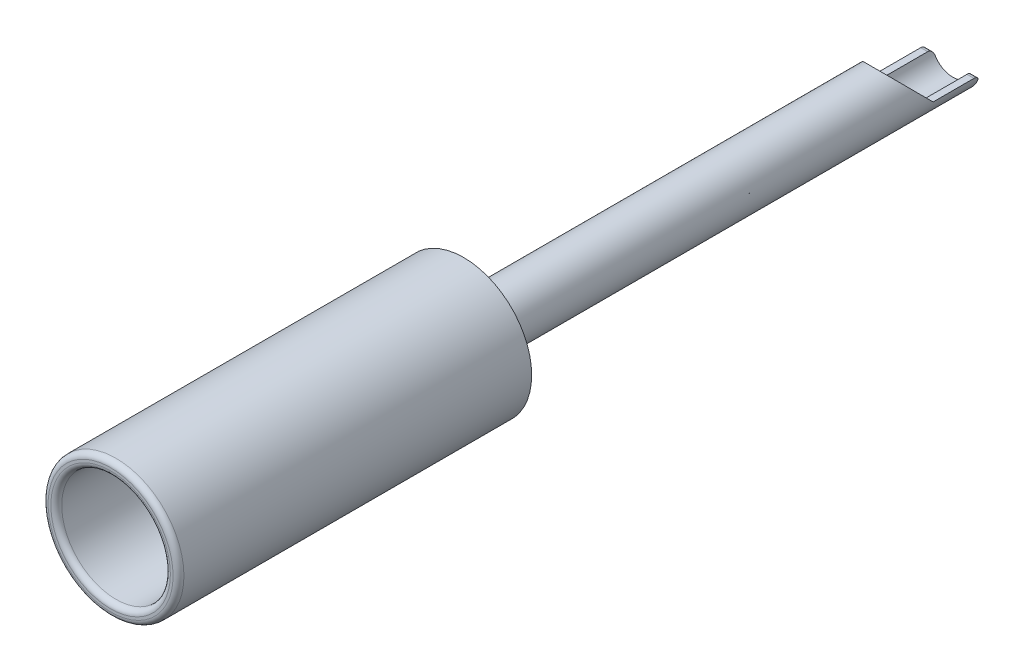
SolidWorks part; units mm, degrees
ref_plane "Plan de face" through (0, 0, 0) normal (0, 0, 1) x (1, 0, 0)
ref_plane "Plan de dessus" through (0, 0, 0) normal (0, 1, 0) x (1, 0, 0)
ref_plane "Plan de droite" through (0, 0, 0) normal (1, 0, 0) x (0, 0, -1)
sketch "Esquisse1" plane through (0, 0, 0) normal (0, 0, 1) x (1, 0, 0)
  circle A0 centre (0, 0) radius 2.5
  dimension "D1" = 5
extrude "Boss.-Extru.1" add sketch "Esquisse1" against normal blind 31
sketch "Esquisse2" plane through (0, 0, 0) normal (0, 0, 1) x (1, 0, 0)
  circle A0 centre (0, 0) radius 2
  dimension "D1" = 4
extrude "Enlèv. mat.-Extru.1" cut sketch "Esquisse2" against normal blind 12
sketch "Esquisse3" plane through (0, 0, -31) normal (0, 0, -1) x (-1, 0, 0)
  circle A0 centre (0, 0) radius 1
  dimension "D1" = 2
extrude "Enlèv. mat.-Extru.2" cut sketch "Esquisse3" against normal blind 18 flip side to cut
sketch "Esquisse4" plane through (0, 0, -31) normal (0, 0, -1) x (-1, 0, 0)
  circle A0 centre (0, 0) radius 0.5
  dimension "D1" = 1
extrude "Enlèv. mat.-Extru.5" cut sketch "Esquisse4" against normal through all
sketch "Esquisse5" plane through (0, 0, -31) normal (0, 0, -1) x (-1, 0, 0)
  circle A0 centre (0, 0) radius 0.75
  dimension "D1" = 1.5
extrude "Enlèv. mat.-Extru.6" cut sketch "Esquisse5" against normal blind 3
fillet "Congé1" radius 0.2 2 edges at (2.5, 0, 0) (2, 0, 0)
sketch "Esquisse6" plane through (0, 0, 0) normal (1, 0, 0) x (0, 0, -1)
  line L0 (27.3, 1.8) -> (29.3, -0.2)
  line L1 (29.3, -0.2) -> (31.5, -0.2)
  line L2 (31.5, -0.2) -> (31.5, 1.8)
  line L3 (31.5, 1.8) -> (27.3, 1.8)
  line L4 (31, -1) -> (31, 1) construction
  line L5 (13, -1) -> (31, -1) construction
  dimension "D1" = 0.5
  dimension "D2" = 2.2
  dimension "D3" = 45
  dimension "D4" = 2
  dimension "D5" = 0.8
extrude "Enlèv. mat.-Extru.7" cut sketch "Esquisse6" against normal mid plane 3
fillet "Congé2" radius 0.2 2 edges at (-0.8513, -0.2, -31) (0.8513, -0.2, -31)
